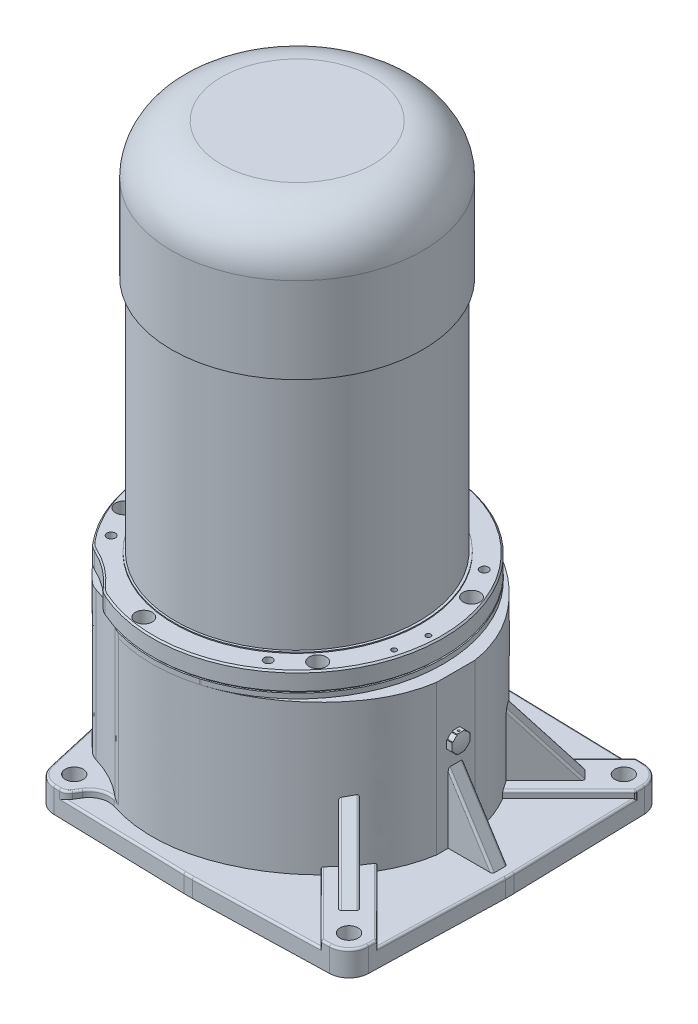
SolidWorks part; units mm, degrees
ref_plane "前视基准面" through (0, 0, 0) normal (0, 0, 1) x (1, 0, 0)
ref_plane "上视基准面" through (0, 0, 0) normal (0, 1, 0) x (1, 0, 0)
ref_plane "右视基准面" through (0, 0, 0) normal (1, 0, 0) x (0, 0, -1)
imported_body "50箱盖-1-surface1"
imported_body "复件 5034.2200.106-00-1-surface1"
imported_body "复件 5034.2200.106-00-1-surface2"
imported_body "复件 5034.2200.106-00-1-surface3"
imported_body "复件 5034.2200.106-00-1-surface4"
imported_body "复件 5034.2200.106-00-1-surface5"
imported_body "复件 5034.2200.106-00-1-surface6"
imported_body "复件 5034.2200.106-00-1-surface7"
imported_body "复件 5034.2200.106-00-1-surface8"
imported_body "复件 5034.2200.106-00-1-surface9"
imported_body "复件 5034.2200.106-00-1-surface10"
imported_body "复件 5034.2200.106-00-1-surface11"
imported_body "复件 5034.2200.106-00-1-surface13"
imported_body "复件 5034.2200.106-00-1-surface14"
imported_body "复件 5034.2200.106-00-1-surface15"
imported_body "复件 5034.2200.106-00-1-surface16"
imported_body "复件 5034.2200.106-00-1-surface17"
imported_body "复件 5034.2200.106-00-1-surface18"
imported_body "复件 5034.2200.106-00-1-surface19"
imported_body "复件 5034.2200.106-00-1-surface20"
imported_body "复件 5034.2200.106-00-1-surface21"
imported_body "复件 5034.2200.106-00-1-surface22"
imported_body "复件 5034.2200.106-00-1-surface23"
imported_body "复件 5034.2200.106-00-1-surface24"
imported_body "复件 5034.2200.106-00-1-surface25"
imported_body "复件 5034.2200.106-00-1-surface26"
imported_body "复件 5034.2200.106-00-1-surface27"
imported_body "复件 5034.2200.106-00-1-surface28"
imported_body "复件 5034.2200.106-00-1-surface29"
imported_body "复件 5034.2200.106-00-1-surface30"
imported_body "复件 5034.2200.106-00-1-surface31"
imported_body "复件 5034.2200.106-00-1-surface32"
imported_body "复件 5034.2200.106-00-1-surface33"
imported_body "复件 5034.2200.106-00-1-surface34"
imported_body "复件 5034.2200.106-00-1-surface35"
imported_body "复件 5034.2200.106-00-1-surface36"
imported_body "复件 5034.2200.106-00-1-surface37"
imported_body "复件 5034.2200.106-00-1-surface38"
imported_body "复件 5034.2200.106-00-1-surface39"
imported_body "复件 5034.2200.106-00-1-surface40"
imported_body "复件 5034.2200.106-00-1-surface41"
imported_body "复件 5034.2200.106-00-1-surface42"
imported_body "复件 5034.2200.106-00-1-surface43"
imported_body "复件 5034.2200.106-00-1-surface44"
imported_body "复件 5034.2200.106-00-1-surface45"
imported_body "复件 5034.2200.106-00-1-surface46"
imported_body "复件 5034.2200.106-00-1-surface47"
imported_body "复件 5034.2200.106-00-1-surface48"
imported_body "复件 5034.2200.106-00-1-surface49"
imported_body "复件 5034.2200.106-00-1-surface50"
imported_body "复件 5034.2200.106-00-1-surface51"
imported_body "复件 5034.2200.106-00-1-surface52"
imported_body "复件 5034.2200.106-00-1-surface53"
imported_body "复件 5034.2200.106-00-1-surface54"
imported_body "复件 5034.2200.106-00-1-surface55"
imported_body "复件 5034.2200.106-00-1-surface56"
imported_body "复件 5034.2200.106-00-1-surface57"
imported_body "复件 5034.2200.106-00-1-surface58"
imported_body "立式箱体-2-surface1"
imported_body "立式箱体-2-surface2"
imported_body "立式箱体-2-surface3"
imported_body "透气塞-1-surface1"
sketch "草图3" plane through (0, -196.7551, 0) normal (0, 1, 0) x (1, 0, 0)
  circle A0 centre (15.5509, 127.454) radius 122
  circle A1 centre (67.5509, 127.454) radius 52 construction
extrude "凸台-拉伸1" add sketch "草图3" along normal blind 239
sketch "草图4" plane through (0, 42.2449, 0) normal (0, 1, 0) x (1, 0, 0)
  circle A0 centre (15.5509, 127.454) radius 126
extrude "凸台-拉伸2" add sketch "草图4" along normal blind 136
fillet "圆角1" radius 50 1 edges at (15.5509, 178.2449, -1.454)
